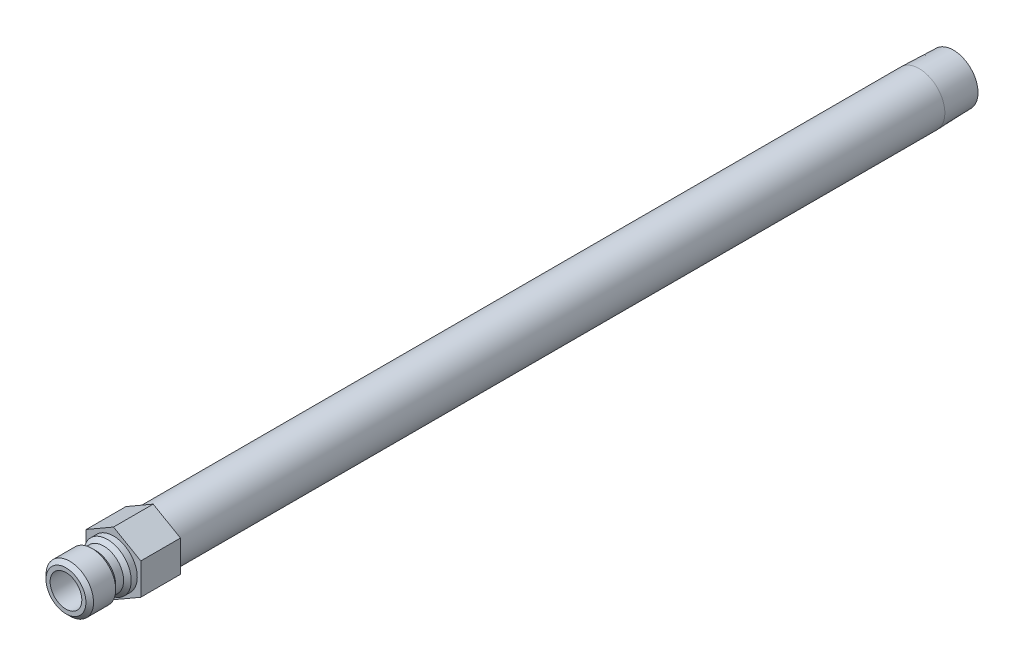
SolidWorks part; units mm, degrees
ref_plane "Front Plane" through (0, 0, 0) normal (0, 0, 1) x (1, 0, 0)
ref_plane "Top Plane" through (0, 0, 0) normal (0, 1, 0) x (1, 0, 0)
ref_plane "Right Plane" through (0, 0, 0) normal (1, 0, 0) x (0, 0, -1)
sketch "Sketch1" plane through (0, 0, 0) normal (1, 0, 0) x (0, 0, -1)
  line L0 (0, 0) -> (-12.7, 0) construction
  line L1 (-9.525, 3.175) -> (-9.525, 4.0005)
  line L2 (-3.556, 4.0005) -> (-3.556, 0) construction
  line L3 (-8.763, 4.7625) -> (-4.318, 4.7625)
  line L4 (0, 5.1435) -> (0, 3.4163) construction
  line L5 (-3.556, 4.0005) -> (-1.9685, 4.0005)
  line L6 (-1.2065, 4.7625) -> (0, 4.7625)
  line L7 (0, 4.7625) -> (0, 5.1435)
  line L8 (-3.556, 4.0005) -> (-4.318, 4.7625)
  line L9 (-1.9685, 4.0005) -> (-1.2065, 4.7625)
  line L10 (-9.525, 4.0005) -> (-8.763, 4.7625)
  line L12 (0, 5.1435) -> (161.417, 5.1435)
  line L13 (161.417, 5.1435) -> (168.275, 4.9292)
  line L14 (168.275, 4.9292) -> (168.275, 2.3813)
  line L15 (0, 0) -> (7.9502, 0) construction
  line L16 (7.9502, 0) -> (7.9502, 4.7625) construction
  line L17 (7.9502, 4.7625) -> (0, 4.7625) construction
  line L18 (0.127, 2.3813) -> (168.275, 2.3813)
  line L19 (0.127, 3.175) -> (-9.525, 3.175)
  line L20 (0, 3.175) -> (0, 0) construction
  line L21 (0.127, 2.3813) -> (0.127, 3.175)
  dimension "D1" = 9.525
  dimension "D2" = 1.5875
  dimension "D3" = 0.762
  dimension "D4" = 45
  dimension "D5" = 5.969
  dimension "D6" = 45
  dimension "D7" = 1.79
  dimension "D8" = 6.858
  dimension "D9" = 177.8
  dimension "D10" = 3.175
  dimension "D11" = 17.4752
  dimension "D12" = 4.7625
  dimension "D13" = 6.35
  dimension "D14" = 9.525
  dimension "D15" = 10.287
  dimension "D16" = 9.652
revolve "Revolve1" add sketch "Sketch1" angle 360 about L0
sketch "Sketch2" plane through (0, 0, 0) normal (0, 0, 1) x (1, 0, 0)
  line L1 (-5.461, 3.1529) -> (-5.461, -3.1529)
  line L2 (-5.461, -3.1529) -> (0, -6.3058)
  line L3 (0, -6.3058) -> (5.461, -3.1529)
  line L4 (5.461, -3.1529) -> (5.461, 3.1529)
  line L5 (5.461, 3.1529) -> (0, 6.3058)
  line L6 (0, 6.3058) -> (-5.461, 3.1529)
  circle A0 centre (0, 0) radius 5.461 construction
  circle A1 centre (0, 0) radius 2.3812 construction
  circle A2 centre (0, 0) radius 2.3812
  dimension "D1" = 10.922
extrude "Boss-Extrude1" add sketch "Sketch2" against normal up to vertex (7.9502 mm away) from vertex at 0
